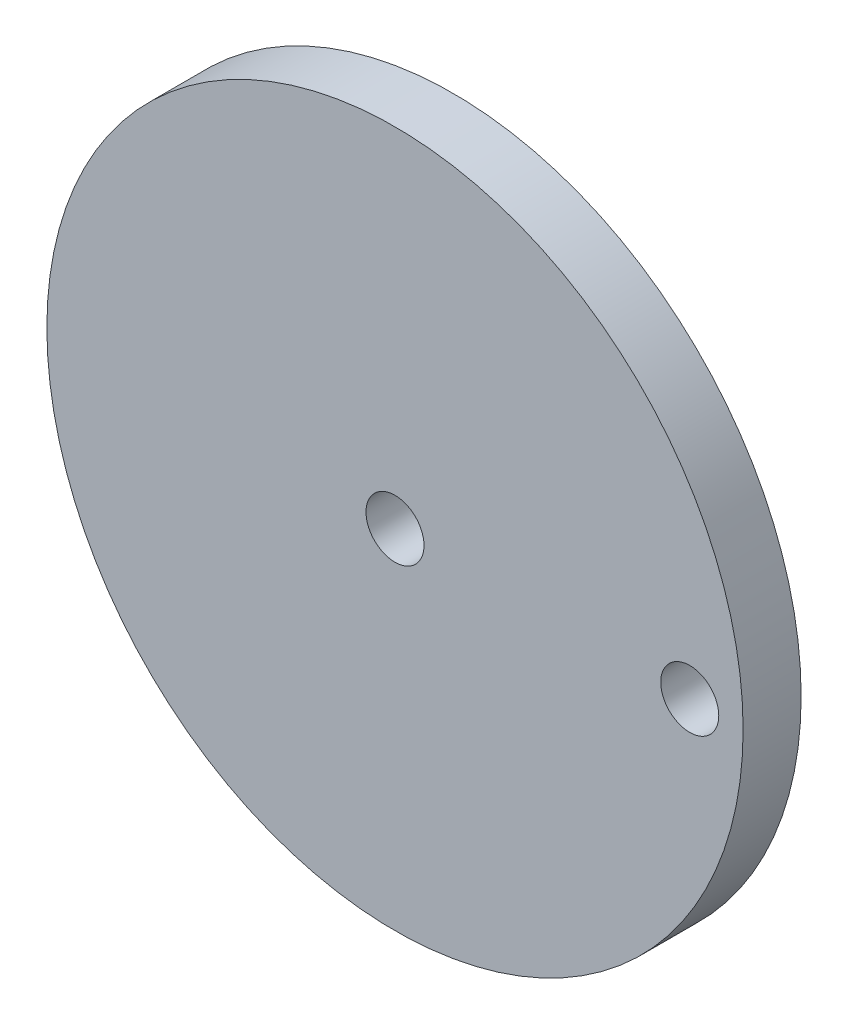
SolidWorks part; units mm, degrees
ref_plane "Front Plane" through (0, 0, 0) normal (0, 0, 1) x (1, 0, 0)
ref_plane "Top Plane" through (0, 0, 0) normal (0, 1, 0) x (1, 0, 0)
ref_plane "Right Plane" through (0, 0, 0) normal (1, 0, 0) x (0, 0, -1)
sketch "Sketch1" plane through (0, 0, 0) normal (0, 0, 1) x (1, 0, 0)
  line L0 (0, 30) -> (0, -30) construction
  line L1 (30, 0) -> (0, 0) construction
  circle A0 centre (0, 0) radius 30
  circle A1 centre (25.4, 0) radius 2.5
  circle A2 centre (0, 0) radius 2.5
  dimension "D1" = 60
  dimension "D2" = 5
  dimension "D4" = 5
  dimension "D3" = 25.4
extrude "Boss-Extrude2" add sketch "Sketch1" along normal blind 5
